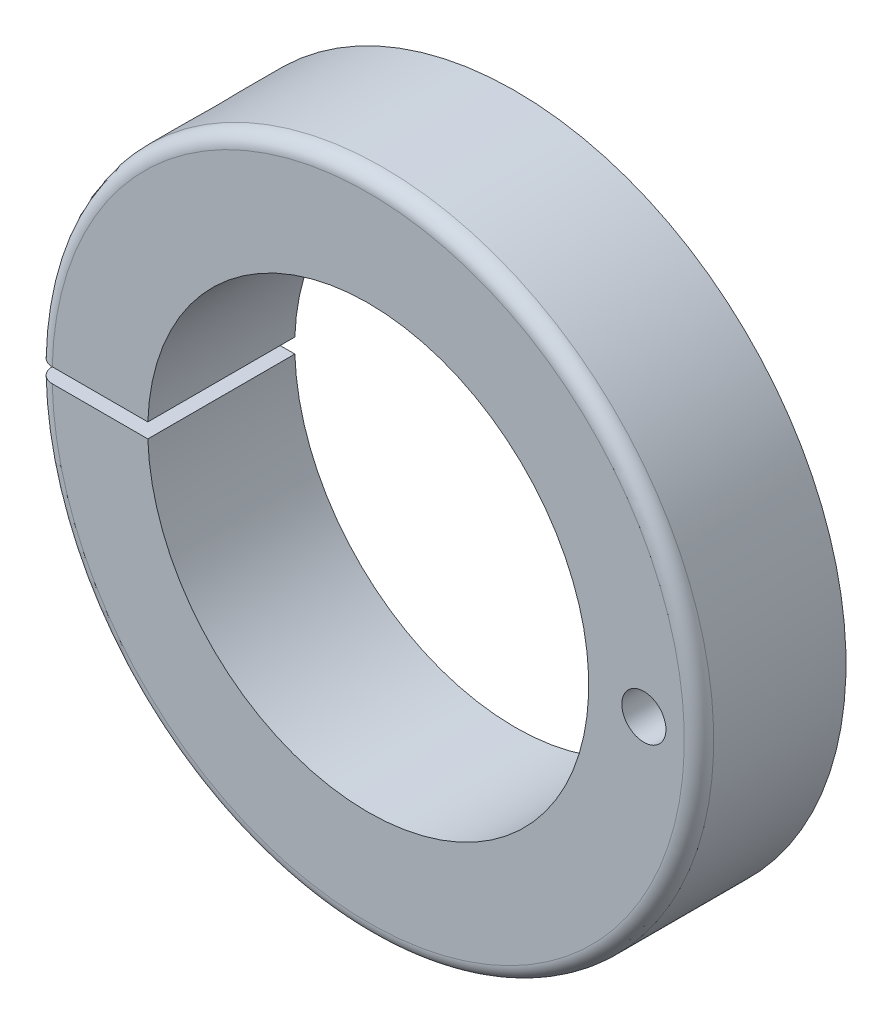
SolidWorks part; units mm, degrees
ref_plane "Plan1" through (0, 0, 0) normal (0, 0, 1) x (1, 0, 0)
ref_plane "Plan2" through (0, 0, 0) normal (0, 1, 0) x (1, 0, 0)
ref_plane "Plan3" through (0, 0, 0) normal (1, 0, 0) x (0, 0, -1)
sketch "Esquisse1" plane through (0, 0, 0) normal (0, 0, 1) x (1, 0, 0)
  circle A0 centre (0, 0) radius 45
extrude "Base-Extrusion" add sketch "Esquisse1" along normal blind 20
sketch "Esquisse2" plane through (0, 0, 20) normal (0, 0, 1) x (1, 0, 0)
  circle A0 centre (0, 0) radius 30
extrude "Enlèv. mat.-Extru.1" cut sketch "Esquisse2" against normal blind 20
sketch "Esquisse3" plane through (0, 0, 20) normal (0, 0, 1) x (1, 0, 0)
  line L1 (-50, 1) -> (-20, 1)
  line L2 (-50, 1) -> (-50, -1)
  line L3 (-50, -1) -> (-20, -1)
  line L4 (-20, 1) -> (-20, -1)
extrude "Enlèv. mat.-Extru.2" cut sketch "Esquisse3" against normal blind 20
ref_plane "Plan4" through (0, 45, 0) normal (0, 1, 0) x (-1, 0, 0)
sketch "Esquisse4" plane through (0, 45, 0) normal (0, 1, 0) x (-1, 0, 0)
  circle A0 centre (37.5, 10) radius 3
extrude "Enlèv. mat.-Extru.3" cut sketch "Esquisse4" against normal through all
sketch "Esquisse5" plane through (0, 45, 0) normal (0, 1, 0) x (-1, 0, 0)
  circle A0 centre (37.5, 10) radius 7
extrude "Enlèv. mat.-Extru.4" cut sketch "Esquisse5" against normal blind 40
fillet "Congé1" radius 2
sketch "Esquisse6" plane through (0, 0, 20) normal (0, 0, 1) x (1, 0, 0)
  circle A0 centre (37.5, 0) radius 3
extrude "Enlèv. mat.-Extru.5" cut sketch "Esquisse6" against normal blind 20
